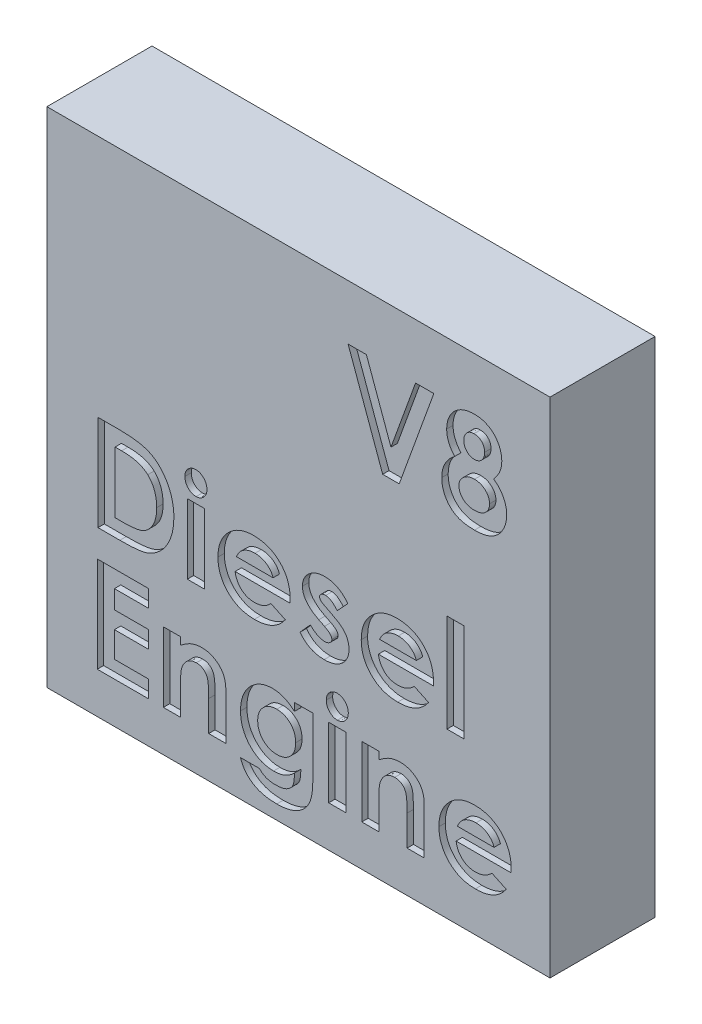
SolidWorks part; units mm, degrees
ref_plane "정면" through (0, 0, 0) normal (0, 0, 1) x (1, 0, 0)
ref_plane "윗면" through (0, 0, 0) normal (0, 1, 0) x (1, 0, 0)
ref_plane "우측면" through (0, 0, 0) normal (1, 0, 0) x (0, 0, -1)
sketch "스케치1" plane through (0.0073, -0.1313, 0) normal (0, 0, 1) x (1, 0, 0)
  line L1 (-8.5849, 7.9996) -> (7.2151, 7.9996)
  line L2 (-8.5849, 7.9996) -> (-8.5849, -7.8004)
  line L3 (-8.5849, -7.8004) -> (7.2151, -7.8004)
  line L4 (7.2151, 7.9996) -> (7.2151, -7.8004)
  dimension "D1" = 15.8
  dimension "D2" = 15.8
extrude "베이스돌출" add sketch "스케치1" against normal blind 3.3
sketch "스케치3" plane through (0, 0, -3.3) normal (0, 0, -1) x (-1, 0, 0)
  line L0 (8.5776, -7.9317) -> (-7.2224, -7.9317) construction
  line L1 (7.0776, -6.4317) -> (-5.7224, -6.4317)
  line L2 (7.0776, -6.4317) -> (7.0776, 6.3683)
  line L3 (7.0776, 6.3683) -> (-5.7224, 6.3683)
  line L4 (-5.7224, -6.4317) -> (-5.7224, 6.3683)
  line L5 (-7.2224, -7.9317) -> (-7.2224, 7.8683) construction
  line L6 (-7.2224, 7.8683) -> (8.5776, 7.8683) construction
  line L7 (8.5776, 7.8683) -> (8.5776, -7.9317) construction
  dimension "D1" = 1.5
  dimension "D2" = 1.5
  dimension "D3" = 1.5
  dimension "D4" = 1.5
extrude "컷-돌출1" cut sketch "스케치3" against normal blind 2
sketch "스케치4" plane through (0, 0, -1.3) normal (0, 0, -1) x (-1, 0, 0)
  line L1 (8.5776, 7.8683) -> (8.5776, -7.9317) construction
  line L2 (8.5776, -7.9317) -> (-7.2224, -7.9317) construction
  circle A0 centre (0.5776, 0.0683) radius 3.25
  circle A1 centre (0.5776, 0.0683) radius 2.5
  dimension "D1" = 8
  dimension "D2" = 8
  dimension "D3" = 5
  dimension "D4" = 6.5
extrude "보스-돌출2" add sketch "스케치4" along normal blind 2
sketch "Sketch1" plane through (0, 0, 0) normal (0, 0, 1) x (1, 0, 0)
  text T0 "V8" font "Century Gothic" height 3
extrude "Cut-Extrude1" cut sketch "Sketch1" against normal blind 0.2
sketch "Sketch2" plane through (0, 0, 0) normal (0, 0, 1) x (1, 0, 0)
  text T0 "Engine" font "Century Gothic" height 3
extrude "Cut-Extrude2" cut sketch "Sketch2" against normal blind 0.2
sketch "Sketch3" plane through (0, 0, 0) normal (0, 0, 1) x (1, 0, 0)
  text T0 "Diesel" font "Century Gothic" height 3
extrude "Cut-Extrude3" cut sketch "Sketch3" against normal blind 0.2
